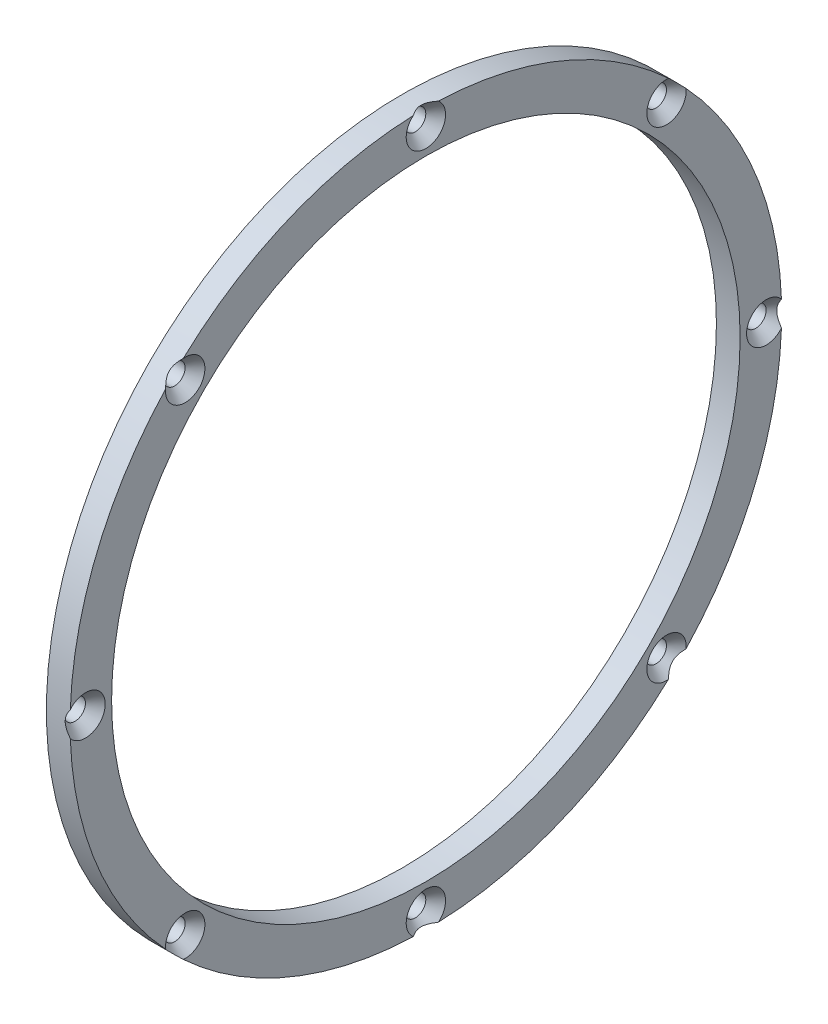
SolidWorks part; units mm, degrees
ref_plane "Front Plane" through (0, 0, 0) normal (0, 0, 1) x (1, 0, 0)
ref_plane "Top Plane" through (0, 0, 0) normal (0, 1, 0) x (1, 0, 0)
ref_plane "Right Plane" through (0, 0, 0) normal (1, 0, 0) x (0, 0, -1)
sketch "Sketch1" plane through (0, 0, 0) normal (1, 0, 0) x (0, 0, -1)
  circle A0 centre (0, 0) radius 76.2
  dimension "D1" = 152.4
extrude "Boss-Extrude1" add sketch "Sketch1" along normal blind 5.08
sketch "Sketch2" plane through (5.08, 0, 0) normal (1, 0, 0) x (0, 0, -1)
  circle A0 centre (0, 0) radius 67.31
extrude "Cut-Extrude1" cut sketch "Sketch2" against normal blind 6.35
hole_wizard "CSK for #8 Flat Head Machine Screw1" positions "Sketch10" profile "Sketch11" countersink size "#8" standard "ANSI Inch"
sketch "Sketch10" plane through (5.08, 0, 0) normal (1, 0, 0) x (0, 0, -1)
  point P0 (0, 72.898)
  dimension "D1" = 72.898
sketch "Sketch11" plane through (5.08, 72.898, 0) normal (0, 1, 0) x (0, 0, -1)
  line L0 (0, 0) -> (0, 8.8437)
  line L1 (0, 8.8437) -> (2.2479, 7.493)
  line L2 (2.2479, 7.493) -> (2.2479, 2.2645)
  line L3 (2.2479, 2.2645) -> (4.2164, 0)
  line L5 (4.2164, 0) -> (0, 0)
  line L6 (-2.2479, 2.2645) -> (-4.2164, 0) construction
  line L10 (0, 8.8437) -> (-2.2479, 7.493) construction
  line L11 (0, -6.35) -> (0, 107.95) construction
  dimension "Hole Dia." = 4.4958
  dimension "Hole Depth" = 7.493
  dimension "Near C'Sink Dia." = 8.4328
  dimension "Near C'Sink Angle" = 82
  dimension "Drill Angle" = 118
pattern_circular "CirPattern1" count 8 over 360 about axis through (0, 0, 0) along (1, 0, 0) of "CSK for #8 Flat Head Machine Screw1"
